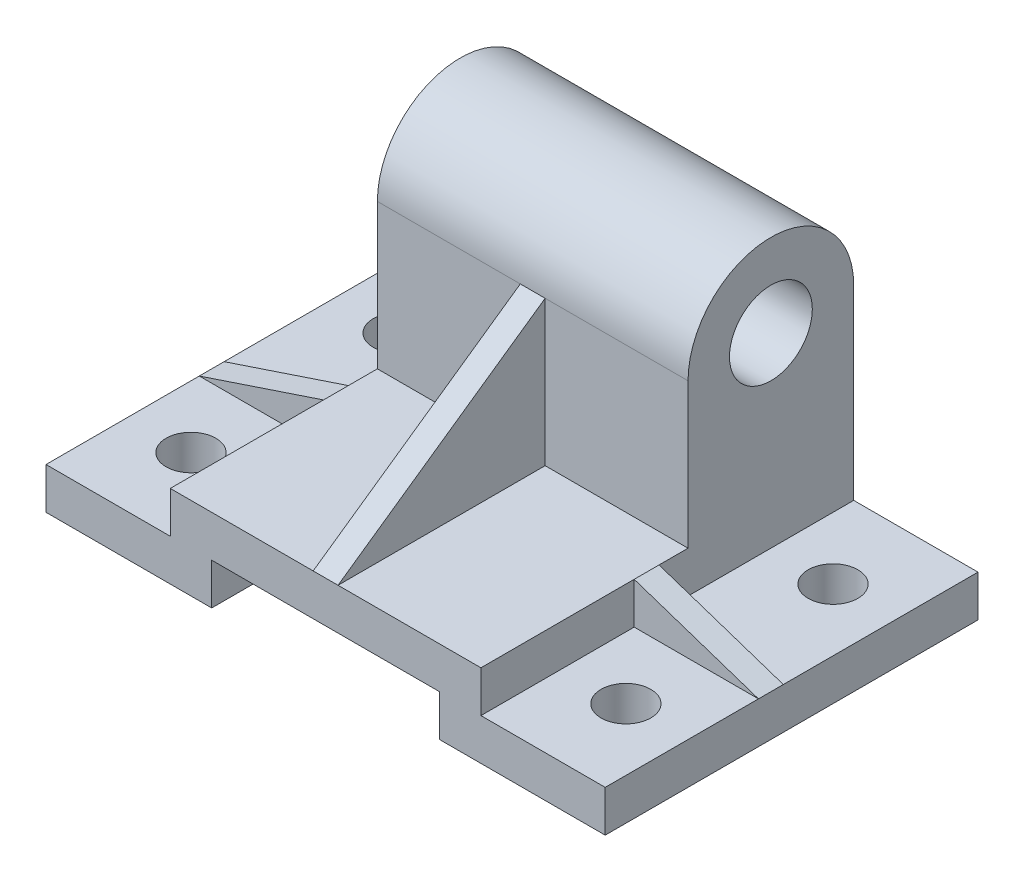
SolidWorks part; units mm, degrees
ref_plane "Front Plane" through (0, 0, 0) normal (0, 0, 1) x (1, 0, 0)
ref_plane "Top Plane" through (0, 0, 0) normal (0, 1, 0) x (1, 0, 0)
ref_plane "Right Plane" through (0, 0, 0) normal (1, 0, 0) x (0, 0, -1)
sketch "Sketch2" plane through (0, 0, 0) normal (0, 0, 1) x (1, 0, 0)
  line L0 (0, 0) -> (0, 10)
  line L1 (0, 0) -> (40, 0)
  line L2 (40, 0) -> (40, 10)
  line L3 (40, 10) -> (95, 10)
  line L4 (95, 10) -> (95, 0)
  line L5 (95, 0) -> (135, 0)
  line L6 (135, 0) -> (135, 10)
  line L7 (135, 10) -> (105, 10)
  line L8 (105, 10) -> (105, 20)
  line L9 (105, 20) -> (30, 20)
  line L10 (30, 20) -> (30, 10)
  line L11 (30, 10) -> (0, 10)
  dimension "D1" = 10
  dimension "D2" = 40
  dimension "D3" = 10
  dimension "D4" = 55
  dimension "D5" = 10
  dimension "D6" = 40
  dimension "D7" = 10
  dimension "D8" = 30
  dimension "D9" = 10
  dimension "D10" = 10
extrude "Boss-Extrude1" add sketch "Sketch2" against normal blind 90
sketch "Sketch3" plane through (0, 10, 0) normal (0, 1, 0) x (1, 0, 0)
  line L0 (0, 0) -> (15, 0) construction
  line L1 (30, 0) -> (0, 0) construction
  line L2 (15, 0) -> (15, 20) construction
  line L3 (67.5, 0) -> (67.5, 90) construction
  line L4 (105, 0) -> (30, 0) construction
  line L5 (105, 90) -> (30, 90) construction
  line L6 (0, 45) -> (135, 45) construction
  line L7 (0, 90) -> (0, 0) construction
  line L8 (135, 90) -> (135, 0) construction
  circle A0 centre (15, 20) radius 6
  circle A1 centre (120, 20) radius 6
  circle A2 centre (15, 70) radius 6
  circle A3 centre (120, 70) radius 6
  dimension "D2" = 12
  dimension "D1" = 20
extrude "Cut-Extrude1" cut sketch "Sketch3" against normal through all
sketch "Sketch4" plane through (30, 0, 0) normal (-1, 0, 0) x (0, 0, 1)
  line L0 (-90, 10) -> (-70, 10) construction
  line L1 (-90, 10) -> (0, 10) construction
  line L2 (-70, 10) -> (-70, 55) construction
  line L3 (-90, 55) -> (-90, 10)
  line L4 (-50, 55) -> (-50, 10)
  line L5 (-90, 10) -> (-50, 10)
  arc A0 (-50, 55) -> (-90, 55) centre (-70, 55) ccw
  dimension "D3" = 40
  dimension "D1" = 20
  dimension "D2" = 45
extrude "Boss-Extrude2" add sketch "Sketch4" against normal blind 75
sketch "Sketch5" plane through (30, 0, 0) normal (-1, 0, 0) x (0, 0, 1)
  circle A0 centre (-70, 55) radius 10
  dimension "D1" = 20
extrude "Cut-Extrude2" cut sketch "Sketch5" against normal through all
ref_plane "Plane1" through (0, 0, -37) normal (0, 0, 1) x (1, 0, 0)
sketch "Sketch6" plane through (0, 0, -37) normal (0, 0, 1) x (1, 0, 0)
  line L0 (0, 10) -> (30, 10)
  line L1 (30, 10) -> (30, 20)
  line L2 (30, 20) -> (0, 10)
extrude "Boss-Extrude3" add sketch "Sketch6" against normal blind 6
sketch "Sketch7" plane through (0, 0, -37) normal (0, 0, 1) x (1, 0, 0)
  line L0 (105, 10) -> (105, 20)
  line L1 (105, 20) -> (135, 10)
  line L2 (135, 10) -> (105, 10)
extrude "Boss-Extrude4" add sketch "Sketch7" against normal blind 6
ref_plane "Plane2" through (67.5, 0, 0) normal (-1, 0, 0) x (0, 0, 1)
sketch "Sketch8" plane through (67.5, 0, 0) normal (-1, 0, 0) x (0, 0, 1)
  line L0 (-50, 20) -> (0, 20)
  line L1 (0, 20) -> (-50, 55)
  line L2 (-50, 55) -> (-50, 20)
extrude "Boss-Extrude5" add sketch "Sketch8" along normal mid plane 6
